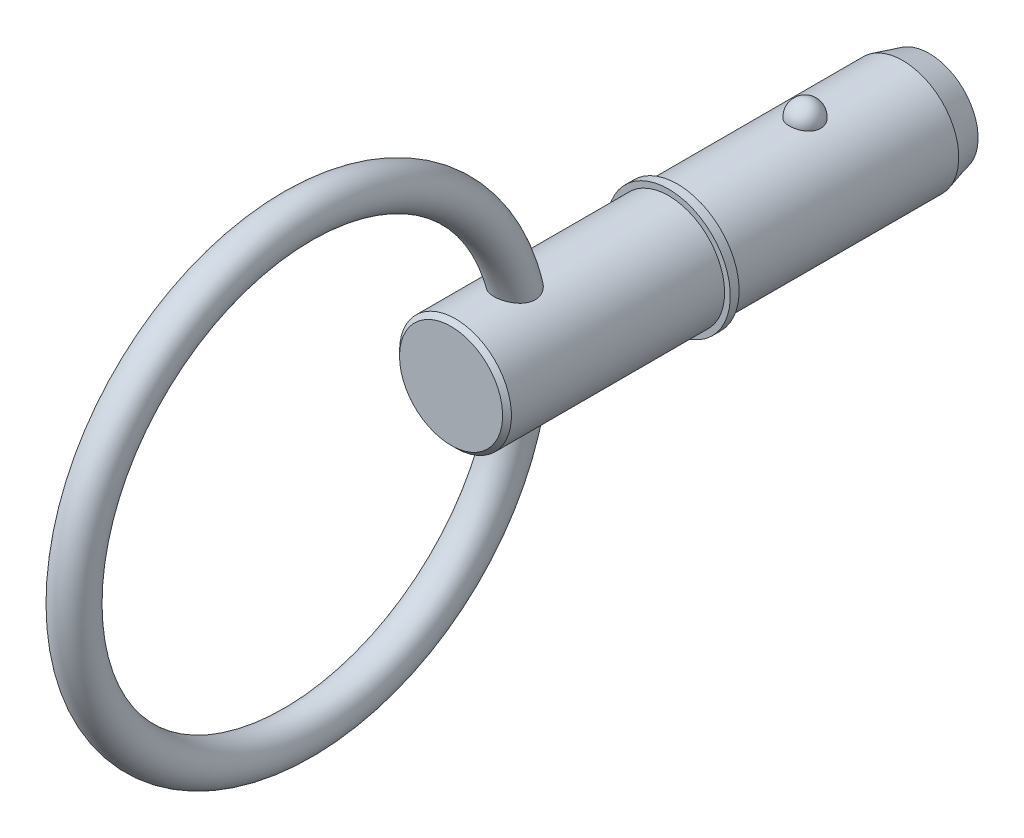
SolidWorks part; units mm, degrees
ref_plane "Front Plane" through (0, 0, 0) normal (0, 0, 1) x (1, 0, 0)
ref_plane "Top Plane" through (0, 0, 0) normal (0, 1, 0) x (1, 0, 0)
ref_plane "Right Plane" through (0, 0, 0) normal (1, 0, 0) x (0, 0, -1)
sketch "Sketch2" plane through (0, 0, 0) normal (0, 0, 1) x (1, 0, 0)
  circle A0 centre (0, 0) radius 6.35
  point P3 (0, 6.35)
  dimension "D1" = 12.7
extrude "Boss-Extrude1" add sketch "Sketch2" along normal blind 12.7
sketch "Sketch3" plane through (0, 0, 0) normal (0, 0, -1) x (-1, 0, 0)
  circle A0 centre (0, 0) radius 6.35
  dimension "D1" = 12.7
extrude "Boss-Extrude2" add sketch "Sketch3" along normal blind 15.88
chamfer "Chamfer1" distance 3 angle 15 1 edges at (-6.35, 0, -15.88)
sketch "Sketch18" plane through (0, 0, 0) normal (1, 0, 0) x (0, 0, -1)
  line L0 (12.88, 6.35) -> (-12.7, 6.35) construction
  line L1 (1.78, 8.13) -> (1.78, 4.57)
  line L2 (-12.7, -6.35) -> (12.88, -6.35) construction
  arc A0 (1.78, 8.13) -> (1.78, 4.57) centre (1.78, 6.35) ccw
  point P4 (0, 6.35)
  dimension "D1" = 14.48
revolve "Revolve1" add sketch "Sketch18" angle 360 about L1
sketch "Sketch19" plane through (0, 0, 0) normal (1, 0, 0) x (0, 0, -1)
  line L0 (-33.7288, 0) -> (-46.4542, 0) construction
sketch "Sketch20" plane through (0, 0, 0) normal (1, 0, 0) x (0, 0, -1)
  line L0 (-12.7, 0) -> (-12.7, 7)
  line L1 (-12.7, 6.35) -> (-12.7, -6.35) construction
  line L2 (-12.7, 7) -> (-13.7, 7)
  line L3 (-13.7, 7) -> (-13.7, 0)
  line L4 (-33.7288, 0) -> (-46.4542, 0) construction
  line L5 (-13.7, 0) -> (-12.7, 0)
  dimension "D1" = 7
  dimension "D2" = 1
revolve "Revolve2" add sketch "Sketch20" angle 360 about L0
sketch "Sketch21" plane through (0, 0, 12.7) normal (0, 0, -1) x (-1, 0, 0)
  circle A0 centre (0, 0) radius 6.35
  dimension "D1" = 12.7
extrude "Boss-Extrude3" add sketch "Sketch21" against normal blind 25.7
chamfer "Chamfer2" distance 0.5 angle 45 1 edges at (-6.35, 0, 38.4)
sketch "Sketch23" plane through (0, 0, 0) normal (1, 0, 0) x (0, 0, -1)
  line L0 (-38.4, 5.85) -> (-38.4, -5.85) construction
  circle A0 centre (-55.8, 0) radius 25.4
  point P2 (-30.4, 0)
  dimension "D1" = 50.8
  dimension "D2" = 8
sketch "Sketch24" plane through (0, 0, 0) normal (0, 1, 0) x (1, 0, 0)
  circle A0 centre (0, -30.4) radius 2.25
  dimension "D1" = 4.5
sweep "Sweep1" add profiles "Sketch24" path "Sketch23"
